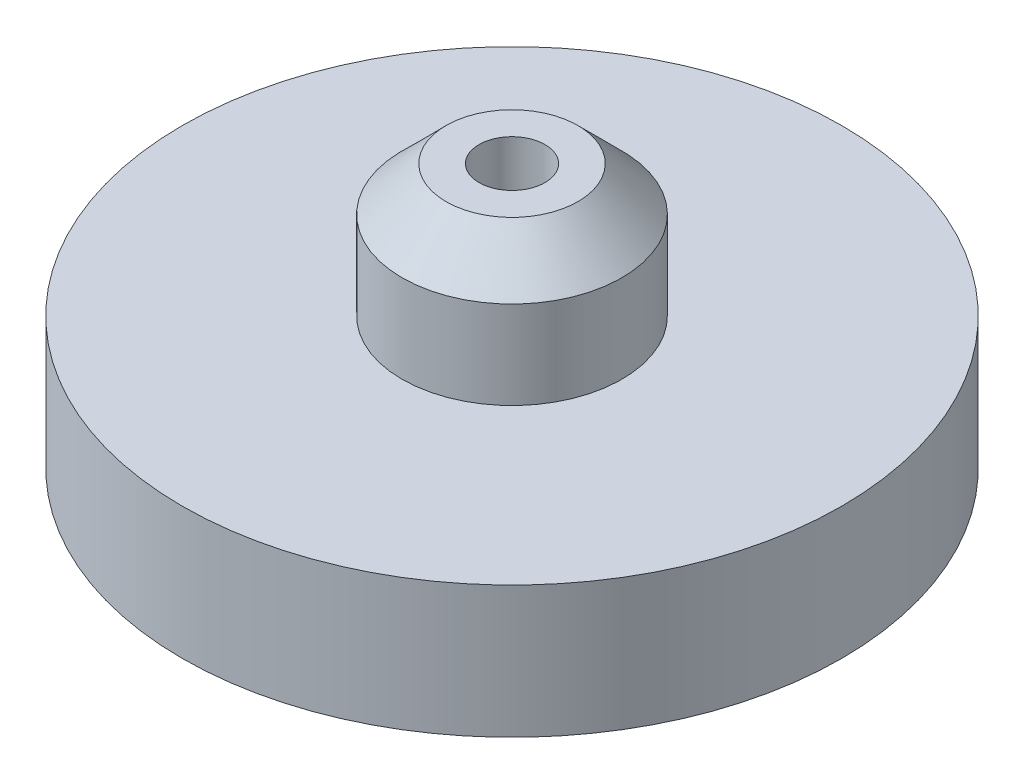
SolidWorks part; units mm, degrees
ref_plane "Front" through (0, 0, 0) normal (0, 0, 1) x (1, 0, 0)
ref_plane "Top" through (0, 0, 0) normal (0, 1, 0) x (1, 0, 0)
ref_plane "Right" through (0, 0, 0) normal (1, 0, 0) x (0, 0, -1)
sketch "Sketch1" plane through (0, 0, 0) normal (0, 1, 0) x (1, 0, 0)
  circle A0 centre (0, 0) radius 15
extrude "Extrude1" add sketch "Sketch1" along normal blind 6
sketch "Sketch2" plane through (0, 6, 0) normal (0, 1, 0) x (-1, 0, 0)
  circle A0 centre (0, 0) radius 5
extrude "Extrude2" add sketch "Sketch2" along normal blind 6
chamfer "Chamfer1" distance 2 angle 45 1 edges at (0, 12, 5)
sketch "Sketch3" plane through (0, 12, 0) normal (0, 1, 0) x (-1, 0, 0)
  circle A0 centre (0, 0) radius 1.5
extrude "Cut-Extrude1" cut sketch "Sketch3" against normal through all
